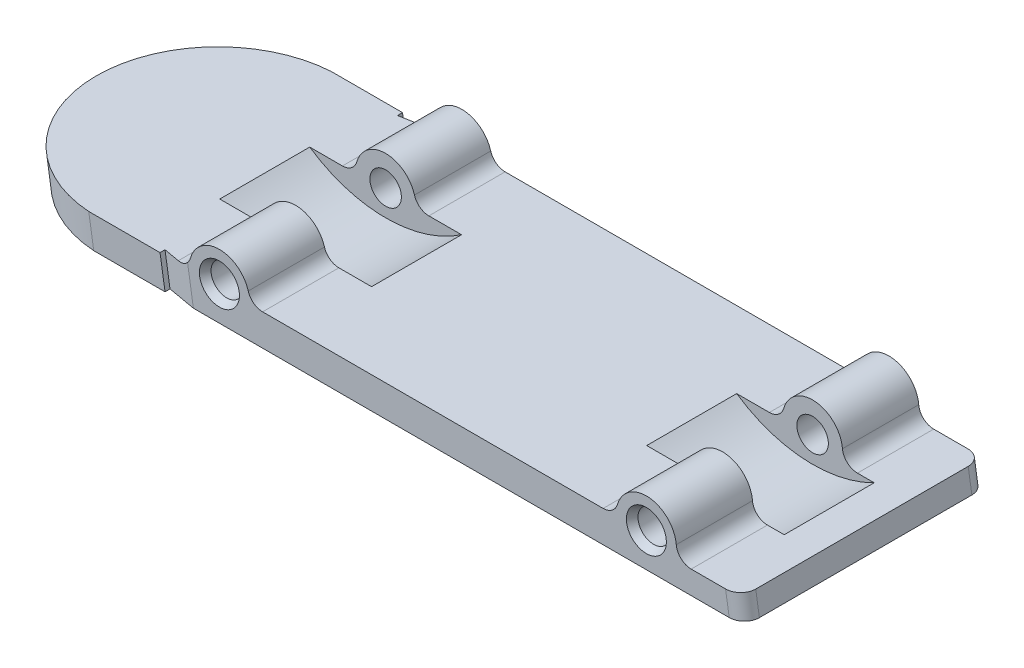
SolidWorks part; units mm, degrees
ref_plane "Front Plane" through (0, 0, 0) normal (0, 0, 1) x (1, 0, 0)
ref_plane "Top Plane" through (0, 0, 0) normal (0, 1, 0) x (1, 0, 0)
ref_plane "Right Plane" through (0, 0, 0) normal (1, 0, 0) x (0, 0, -1)
sketch "Sketch1" plane through (0, 0, 0) normal (0, 0, 1) x (1, 0, 0)
  line L0 (0, 0) -> (-0.2534, 1.6002)
  line L1 (-0.2534, 1.6002) -> (9.9648, 1.6002)
  line L2 (14.3568, 1.6002) -> (31.6564, 1.6002)
  line L3 (36.1293, 1.1684) -> (38.647, 1.1684)
  line L4 (38.647, 1.1684) -> (38.8321, 0)
  line L5 (38.8321, 0) -> (0, 0)
  arc A0 (10.6968, 2.1505) -> (13.6248, 2.1505) centre (12.1608, 1.7272) cw
  arc A1 (32.3884, 2.1505) -> (35.3704, 1.8627) centre (33.8524, 1.7272) cw
  circle A2 centre (12.1608, 1.7272) radius 0.8001
  circle A3 centre (33.8524, 1.7272) radius 0.8001
  arc A4 (36.1293, 1.1684) -> (35.3704, 1.8627) centre (36.1293, 1.9304) cw
  arc A5 (32.3884, 2.1505) -> (31.6564, 1.6002) centre (31.6564, 2.3622) cw
  arc A6 (14.3568, 1.6002) -> (13.6248, 2.1505) centre (14.3568, 2.3622) cw
  arc A7 (9.9648, 1.6002) -> (10.6968, 2.1505) centre (9.9648, 2.3622) ccw
  dimension "D1" = 38.354
  dimension "D5" = 1.6002
  dimension "D8" = 1.524
  dimension "D9" = 0.762
  dimension "D2" = 81
  dimension "D3" = 1.6002
  dimension "D4" = 21.6916
  dimension "D6" = 1.7272
  dimension "D7" = 1.1684
  dimension "D10" = 4.6482
extrude "Boss-Extrude1" add sketch "Sketch1" along normal blind 12.319
sketch "Sketch2" plane through (0, 1.6002, 0) normal (0, 1, 0) x (1, 0, 0)
  line L0 (10.6968, -12.319) -> (10.6968, 0) construction
  line L1 (-0.2534, -12.319) -> (-0.2534, 0) construction
  line L2 (9.9648, 0) -> (-0.2534, 0) construction
  line L3 (9.9648, -12.319) -> (-0.2534, -12.319) construction
  line L8 (9.9648, 0) -> (-0.2534, 0)
  line L9 (-0.2534, 0) -> (-0.2534, -12.319)
  line L10 (-0.2534, -12.319) -> (9.9648, -12.319)
  line L11 (9.9648, -12.319) -> (9.9648, 0)
  line L12 (5.523, 0) -> (-0.2534, 0)
  line L13 (-0.2534, 0) -> (-0.2534, -12.319)
  line L14 (-0.2534, -12.319) -> (5.523, -12.319)
  arc A0 (5.523, -12.319) -> (5.523, 0) centre (5.9188, -6.1595) cw
  point P9 (10.6968, -6.1595)
  dimension "D1" = 6.1722
  dimension "D2" = 0
extrude "Cut-Extrude1" cut sketch "Sketch2" along direction (0.1564, -0.9877, 0) on the side against the normal blind 12.319 contours A0 L13 M7 | A0 M6 M5
sketch "Sketch4" plane through (0, 1.6002, 0) normal (0, 1, 0) x (1, 0, 0)
  line L0 (9.1446, 0) -> (9.1446, -0.254)
  line L1 (9.9648, 0) -> (5.523, 0) construction
  line L2 (9.1446, -0.254) -> (10.5851, 0)
  line L3 (-0.2534, -6.1595) -> (24.6487, -6.1595) construction
  line L4 (9.1446, 0) -> (10.5851, 0)
  line L5 (9.1446, -12.319) -> (10.5851, -12.319)
  line L6 (9.1446, -12.065) -> (10.5851, -12.319)
  line L7 (9.1446, -12.319) -> (9.1446, -12.065)
  arc A0 (5.523, 0) -> (5.523, -12.319) centre (5.9188, -6.1595) ccw construction
  dimension "D1" = 10
  dimension "D2" = 9.398
  dimension "D3" = 0.254
extrude "Cut-Extrude2" cut sketch "Sketch4" along direction (-0.1564, 0.9877, 0) on the side against the normal mid plane 12.319
ref_plane "Plane1" through (0, 0, 6.1595) normal (0, 0, 1) x (1, 0, 0)
sketch "Sketch5" plane through (0, 0, 6.1595) normal (0, 0, 1) x (1, 0, 0)
  line L0 (5.918, 4.432) -> (18.1697, 3.9656)
  line L1 (27.729, 4.183) -> (40.0346, 4.3025)
  arc A0 (5.918, 4.432) -> (18.1697, 3.9656) centre (12.1608, 7.271) ccw
  arc A1 (27.729, 4.183) -> (40.0346, 4.3025) centre (33.8524, 7.271) ccw
  arc A2 (13.6248, 2.1505) -> (10.6968, 2.1505) centre (12.1608, 1.7272) ccw construction
  arc A3 (35.3704, 1.8627) -> (32.3884, 2.1505) centre (33.8524, 1.7272) ccw construction
  point P6 (12.1608, 3.2512)
  point P7 (33.8524, 3.2512)
  dimension "D1" = 6.858
extrude "Cut-Extrude3" cut sketch "Sketch5" against normal mid plane 4.572
chamfer "Chamfer1" distance 0.2159 angle 60 4 edges at (34.6525, 1.7272, 0) (12.9609, 1.7272, 0) (34.6525, 1.7272, 12.319) (12.9609, 1.7272, 12.319)
fillet "Fillet1" radius 0.762 1 edges at (38.7396, 0.5842, 12.319)
fillet "Fillet2" radius 0.762 1 edges at (38.7396, 0.5842, 0)
